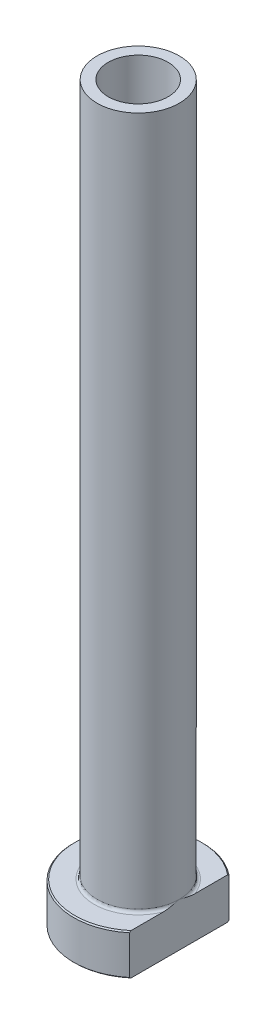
SolidWorks part; units mm, degrees
ref_plane "Front Plane" through (0, 0, 0) normal (0, 0, 1) x (1, 0, 0)
ref_plane "Top Plane" through (0, 0, 0) normal (0, 1, 0) x (1, 0, 0)
ref_plane "Right Plane" through (0, 0, 0) normal (1, 0, 0) x (0, 0, -1)
sketch "Sketch1" plane through (0, 0, 0) normal (0, 0, 1) x (1, 0, 0)
  line L0 (-5.1, 125) -> (-7, 125)
  line L1 (-7, 125) -> (-7, 7)
  line L2 (-7, 7) -> (-11, 7)
  line L3 (-11, 7) -> (-11, 0)
  line L4 (9.9, 0) -> (-9.9, 0) construction
  line L5 (-11, 0) -> (-5.35, 0)
  line L6 (-5.1, 70) -> (-5.1, 125)
  line L7 (0, 92.1877) -> (0, -15.5353) construction
  line L8 (0, -12.1) -> (0, 12.1) construction
  line L9 (-5.1, 70) -> (-5.35, 58)
  line L10 (-5.35, 58) -> (-5.35, 0)
  dimension "D1" = 0.25
  dimension "ID" = 10.2
  dimension "OD" = 14
  dimension "L" = 125
  dimension "H" = 22
  dimension "T" = 7
  dimension "N" = 55
  dimension "D2" = 12
  dimension "L-N" = 70
revolve "Revolve1" add sketch "Sketch1" angle 360 about L7
fillet "Fillet1" radius 0.5 1 edges at (0, 7, 7)
chamfer "Chamfer1" distance 0.2 angle 45 2 edges at (0, 7, 11) (0, 0, 11)
sketch "Sketch2" plane through (0, 0, 0) normal (0, -1, 0) x (1, 0, 0)
  line L0 (7, 8.4853) -> (7, -8.4853)
  circle A0 centre (0, 0) radius 11 construction
  arc A1 (7, 8.4853) -> (7, -8.4853) centre (0, 0) cw
  circle A2 centre (0, 0) radius 7 construction
extrude "Cut-Extrude1" cut sketch "Sketch2" against normal through all
chamfer "Chamfer2" distance 0.5 angle 45 1 edges at (0, 0, 5.35)
